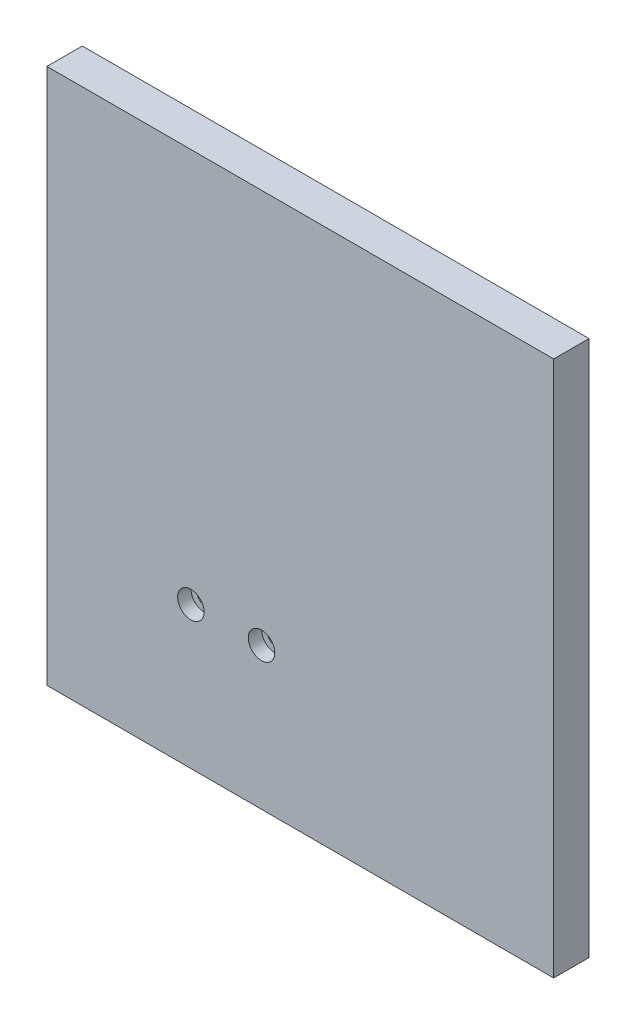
SolidWorks part; units mm, degrees
ref_plane "Front Plane" through (0, 0, 0) normal (0, 0, 1) x (1, 0, 0)
ref_plane "Top Plane" through (0, 0, 0) normal (0, 1, 0) x (1, 0, 0)
ref_plane "Right Plane" through (0, 0, 0) normal (1, 0, 0) x (0, 0, -1)
sketch "Sketch1" plane through (0, 0, 0) normal (0, 0, 1) x (1, 0, 0)
  line L1 (-45.3722, 146.7561) -> (136.7824, 146.7561)
  line L2 (-45.3722, 146.7561) -> (-45.3722, -45.9615)
  line L3 (-45.3722, -45.9615) -> (136.7824, -45.9615)
  line L4 (136.7824, 146.7561) -> (136.7824, -45.9615)
extrude "Extrude1" add sketch "Sketch1" along normal blind 12.7
hole_wizard "CBORE for #10 Socket Head Cap Screw1" positions "Sketch3" profile "Sketch2" counterbore size "#10" standard "Ansi Inch"
sketch "Sketch3" plane through (0, 0, 12.7) normal (0, 0, 1) x (1, 0, 0)
  circle A0 centre (31.75, 5.08) radius 2.0193 construction
  circle A1 centre (6.35, 5.08) radius 2.0193 construction
  point P0 (31.75, 5.08)
  point P1 (6.35, 5.08)
sketch "Sketch2" plane through (31.75, 5.08, 12.7) normal (1, 0, 0) x (0, -1, 0)
  line L0 (0, 0) -> (0, 12.7)
  line L1 (0, 12.7) -> (2.5527, 12.7)
  line L3 (2.5527, 12.7) -> (2.5527, 4.826)
  line L4 (2.5527, 4.826) -> (4.7625, 4.826)
  line L5 (4.7625, 4.826) -> (4.7625, 0)
  line L7 (4.7625, 0) -> (0, 0)
  line L11 (0, -6.35) -> (0, 107.95) construction
  dimension "Thru Hole Dia." = 5.1054
  dimension "Thru Hole Depth" = 12.7
  dimension "C'Bore Dia." = 9.525
  dimension "C'Bore Depth" = 4.826
